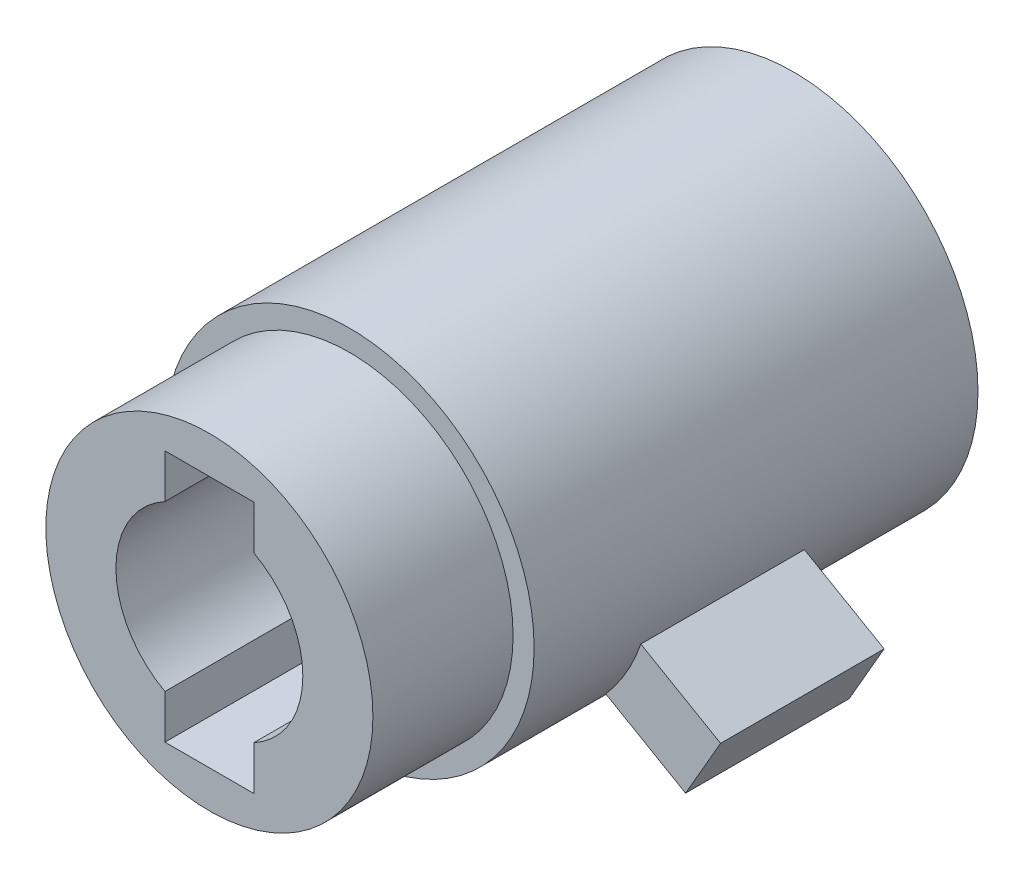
SolidWorks part; units mm, degrees
ref_plane "Face" through (0, 0, 0) normal (0, 0, 1) x (1, 0, 0)
ref_plane "Dessus" through (0, 0, 0) normal (0, 1, 0) x (1, 0, 0)
ref_plane "Droite" through (0, 0, 0) normal (1, 0, 0) x (0, 0, -1)
sketch "Esquisse1" plane through (0, 0, 0) normal (0, 0, 1) x (1, 0, 0)
  line L0 (0, 0) -> (0, 4.0114) construction
  line L1 (0, 0) -> (4.6977, 0) construction
  line L2 (-0.95, 2.7) -> (0.95, 2.7)
  line L3 (0.95, 2.7) -> (0.95, 1.76)
  line L4 (-0.95, 2.7) -> (-0.95, 1.76)
  line L5 (-0.95, -2.7) -> (-0.95, -1.76)
  line L6 (0.95, -2.7) -> (0.95, -1.76)
  line L7 (-0.95, -2.7) -> (0.95, -2.7)
  circle A0 centre (0, 0) radius 3.5
  arc A1 (0.95, -1.76) -> (0.95, 1.76) centre (0, 0) ccw
  arc A2 (-0.95, 1.76) -> (-0.95, -1.76) centre (0, 0) ccw
  point P4 (0, -2.7)
  point P11 (0, 2.7)
  dimension "D1" = 7
  dimension "D2" = 4
  dimension "D3" = 1.9
  dimension "D4" = 5.4
extrude "Extrusion1" add sketch "Esquisse1" along normal blind 9.2
sketch "Esquisse2" plane through (0, 0, 9.2) normal (0, 0, 1) x (1, 0, 0)
  circle A0 centre (0, 0) radius 3.95
  circle A1 centre (0, 0) radius 2.7
  dimension "D2" = 7.9
extrude "Extrusion2" add sketch "Esquisse2" against normal blind 9.5 from offset 3
sketch "Esquisse3" plane through (0, 0, 6.2) normal (0, 0, 1) x (1, 0, 0)
  line L0 (0, 0) -> (5.2139, 0) construction
  line L1 (0, 0) -> (5.0662, -2.925) construction
  line L2 (5.4412, -2.2755) -> (3.7336, -1.2896)
  line L3 (5.4412, -2.2755) -> (4.6912, -3.5745)
  line L4 (4.6912, -3.5745) -> (2.9836, -2.5886)
  circle A5 centre (0, 0) radius 3.95 construction
  arc A6 (2.9836, -2.5886) -> (3.7336, -1.2896) centre (0, 0) ccw
  dimension "D1" = 30
  dimension "D2" = 1.5
  dimension "D3" = 9.8
extrude "Extrusion3" add sketch "Esquisse3" against normal blind 3.5 from offset 2.5
sketch "Esquisse4" plane through (0, 0, 6.2) normal (0, 0, 1) x (1, 0, 0)
  line L0 (0, 0) -> (-4.5041, 0) construction
  line L1 (0, 0) -> (-5.0662, -2.925) construction
  line L2 (-5.4412, -2.2755) -> (-3.7336, -1.2896)
  line L3 (-5.4412, -2.2755) -> (-4.6912, -3.5745)
  line L5 (-4.6912, -3.5745) -> (-2.9836, -2.5886)
  circle A1 centre (0, 0) radius 3.95 construction
  arc A2 (-3.7336, -1.2896) -> (-2.9836, -2.5886) centre (0, 0) ccw
  dimension "D1" = 30
  dimension "D2" = 9.8
  dimension "D3" = 0.75
extrude "Extrusion4" add sketch "Esquisse4" against normal blind 3.1
